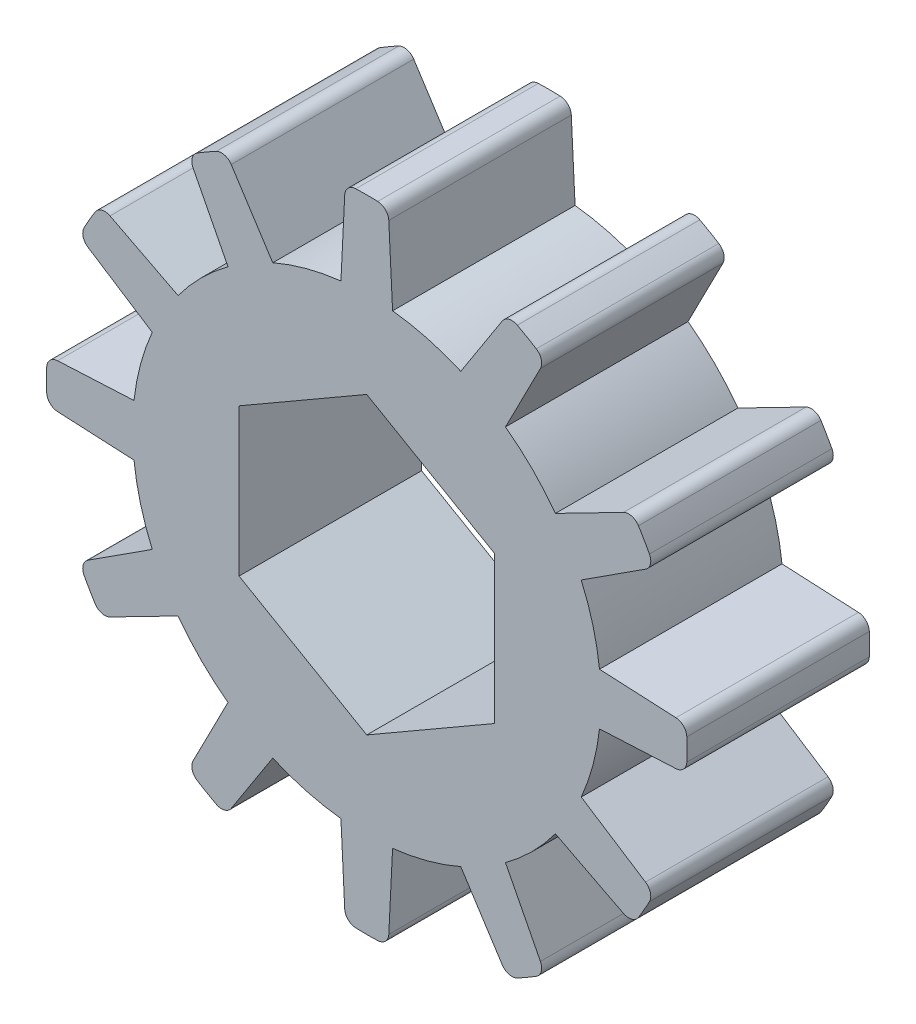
SolidWorks part; units mm, degrees
ref_plane "Alzado" through (0, 0, 0) normal (0, 0, 1) x (1, 0, 0)
ref_plane "Planta" through (0, 0, 0) normal (0, 1, 0) x (1, 0, 0)
ref_plane "Vista lateral" through (0, 0, 0) normal (1, 0, 0) x (0, 0, -1)
sketch "Croquis1" plane through (0, 0, 0) normal (0, 0, 1) x (1, 0, 0)
  line L0 (0, 0) -> (0, 4.6049) construction
  line L1 (0.375, 5.5679) -> (0.45, 4.0556)
  line L2 (-0.375, 5.5679) -> (-0.45, 4.0556)
  line L3 (2.4592, 5.0094) -> (1.6381, 3.7373)
  line L4 (3.1087, 4.6344) -> (2.4175, 3.2873)
  line L5 (4.6344, 3.1087) -> (3.2873, 2.4175)
  line L6 (5.0094, 2.4592) -> (3.7373, 1.6381)
  line L7 (5.5679, 0.375) -> (4.0556, 0.45)
  line L8 (5.5679, -0.375) -> (4.0556, -0.45)
  line L9 (5.0094, -2.4592) -> (3.7373, -1.6381)
  line L10 (4.6344, -3.1087) -> (3.2873, -2.4175)
  line L11 (3.1087, -4.6344) -> (2.4175, -3.2873)
  line L12 (2.4592, -5.0094) -> (1.6381, -3.7373)
  line L13 (0.375, -5.5679) -> (0.45, -4.0556)
  line L14 (-0.375, -5.5679) -> (-0.45, -4.0556)
  line L15 (-2.4592, -5.0094) -> (-1.6381, -3.7373)
  line L16 (-3.1087, -4.6344) -> (-2.4175, -3.2873)
  line L17 (-4.6344, -3.1087) -> (-3.2873, -2.4175)
  line L18 (-5.0094, -2.4592) -> (-3.7373, -1.6381)
  line L19 (-5.5679, -0.375) -> (-4.0556, -0.45)
  line L20 (-5.5679, 0.375) -> (-4.0556, 0.45)
  line L21 (-5.0094, 2.4592) -> (-3.7373, 1.6381)
  line L22 (-4.6344, 3.1087) -> (-3.2873, 2.4175)
  line L23 (-3.1087, 4.6344) -> (-2.4175, 3.2873)
  line L24 (-2.4592, 5.0094) -> (-1.6381, 3.7373)
  circle A0 centre (0, 0) radius 0.5
  arc A1 (1.6381, 3.7373) -> (0.45, 4.0556) centre (0, 0) ccw
  arc A2 (3.1087, 4.6344) -> (2.4592, 5.0094) centre (0, 0) ccw
  arc A3 (5.0094, 2.4592) -> (4.6344, 3.1087) centre (0, 0) ccw
  arc A4 (5.5679, -0.375) -> (5.5679, 0.375) centre (0, 0) ccw
  arc A5 (4.6344, -3.1087) -> (5.0094, -2.4592) centre (0, 0) ccw
  arc A6 (2.4592, -5.0094) -> (3.1087, -4.6344) centre (0, 0) ccw
  arc A7 (-0.375, -5.5679) -> (0.375, -5.5679) centre (0, 0) ccw
  arc A8 (-3.1087, -4.6344) -> (-2.4592, -5.0094) centre (0, 0) ccw
  arc A9 (-5.0094, -2.4592) -> (-4.6344, -3.1087) centre (0, 0) ccw
  arc A10 (-5.5679, 0.375) -> (-5.5679, -0.375) centre (0, 0) ccw
  arc A11 (-4.6344, 3.1087) -> (-5.0094, 2.4592) centre (0, 0) ccw
  arc A12 (-2.4592, 5.0094) -> (-3.1087, 4.6344) centre (0, 0) ccw
  arc A13 (0.375, 5.5679) -> (-0.375, 5.5679) centre (0, 0) ccw
  arc A14 (3.2873, 2.4175) -> (2.4175, 3.2873) centre (0, 0) ccw
  arc A15 (4.0556, 0.45) -> (3.7373, 1.6381) centre (0, 0) ccw
  arc A16 (3.7373, -1.6381) -> (4.0556, -0.45) centre (0, 0) ccw
  arc A17 (2.4175, -3.2873) -> (3.2873, -2.4175) centre (0, 0) ccw
  arc A18 (0.45, -4.0556) -> (1.6381, -3.7373) centre (0, 0) ccw
  arc A19 (-1.6381, -3.7373) -> (-0.45, -4.0556) centre (0, 0) ccw
  arc A20 (-3.2873, -2.4175) -> (-2.4175, -3.2873) centre (0, 0) ccw
  arc A21 (-4.0556, -0.45) -> (-3.7373, -1.6381) centre (0, 0) ccw
  arc A22 (-3.7373, 1.6381) -> (-4.0556, 0.45) centre (0, 0) ccw
  arc A23 (-2.4175, 3.2873) -> (-3.2873, 2.4175) centre (0, 0) ccw
  arc A24 (-0.45, 4.0556) -> (-1.6381, 3.7373) centre (0, 0) ccw
  dimension "D1" = 0.9
  dimension "D2" = 1
  dimension "D4" = 1.5
  dimension "D3" = 0.75
  dimension "D6" = 1.23
  dimension "D5" = 12
extrude "Saliente-Extruir1" add sketch "Croquis1" along normal blind 3.18
sketch "Croquis10" plane through (0, 0, 0) normal (0, 0, -1) x (-1, 0, 0)
  line L1 (0, -2.5692) -> (2.225, -1.2846)
  line L2 (2.225, -1.2846) -> (2.225, 1.2846)
  line L3 (2.225, 1.2846) -> (0, 2.5692)
  line L4 (0, 2.5692) -> (-2.225, 1.2846)
  line L5 (-2.225, 1.2846) -> (-2.225, -1.2846)
  line L6 (-2.225, -1.2846) -> (0, -2.5692)
  circle A0 centre (0, 0) radius 2.225 construction
  dimension "D1" = 4.45
extrude "Cortar-Extruir3" cut sketch "Croquis10" against normal through all
fillet "Redondeo1" radius 0.2 24 edges at (5.5679, -0.375, 1.59) (-2.4592, -5.0094, 1.59) (-3.1087, -4.6344, 1.59) (0.375, -5.5679, 1.59) (-0.375, -5.5679, 1.59) (3.1087, -4.6344, 1.59) (2.4592, -5.0094, 1.59) (5.0094, -2.4592, 1.59) (4.6344, -3.1087, 1.59) (-4.6344, -3.1087, 1.59) (-5.0094, -2.4592, 1.59) (-5.5679, -0.375, 1.59) (-5.5679, 0.375, 1.59) (-5.0094, 2.4592, 1.59) (-4.6344, 3.1087, 1.59) (-3.1087, 4.6344, 1.59) (-2.4592, 5.0094, 1.59) (5.5679, 0.375, 1.59) (5.0094, 2.4592, 1.59) (4.6344, 3.1087, 1.59) (3.1087, 4.6344, 1.59) (2.4592, 5.0094, 1.59) (0.375, 5.5679, 1.59) (-0.375, 5.5679, 1.59)
